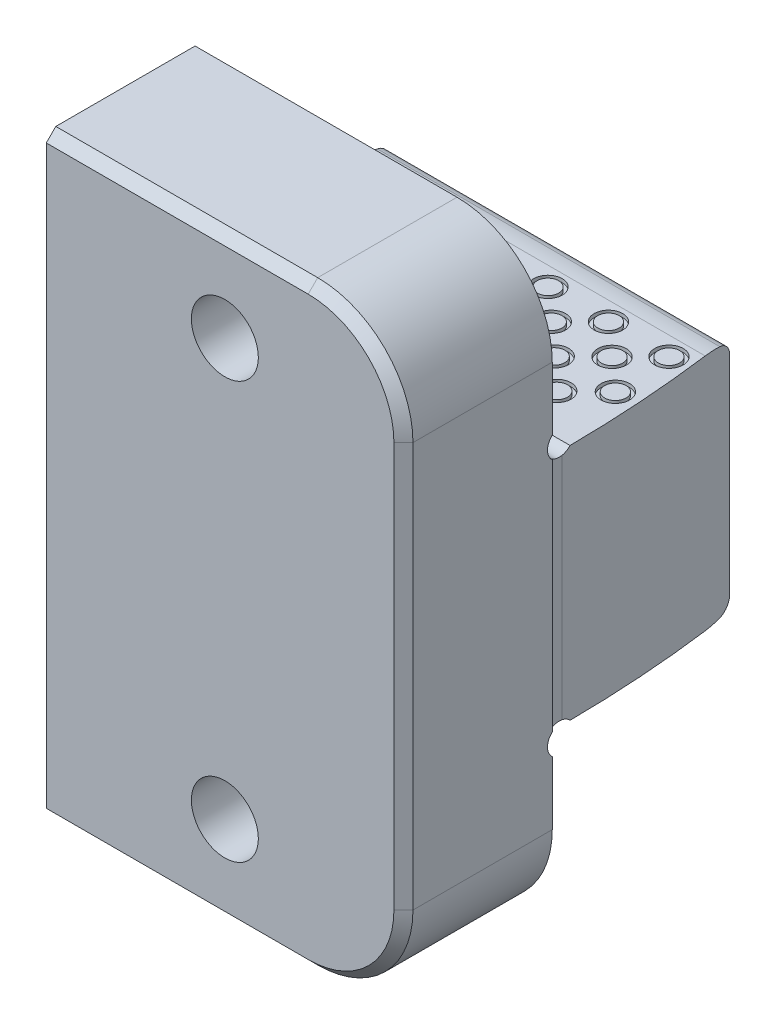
SolidWorks part; units mm, degrees
ref_plane "Front Plane" through (0, 0, 0) normal (0, 0, 1) x (1, 0, 0)
ref_plane "Top Plane" through (0, 0, 0) normal (0, 1, 0) x (1, 0, 0)
ref_plane "Right Plane" through (0, 0, 0) normal (1, 0, 0) x (0, 0, -1)
sketch "Sketch3" plane through (0, 0, 0) normal (1, 0, 0) x (0, 0, -1)
  line L0 (0, 20.955) -> (0, -20.955) construction
  line L1 (-15.875, -31.75) -> (0, -31.75)
  line L2 (-15.875, -31.75) -> (-15.875, 31.75)
  line L3 (-15.875, 31.75) -> (0, 31.75)
  line L4 (20.6756, -12.6975) -> (20.6756, 12.6975)
  line L6 (0, -31.75) -> (0, -12.6975)
  line L7 (0, -12.6975) -> (20.6756, -12.6975)
  line L8 (0, 31.75) -> (0, 12.6975)
  line L9 (0, 12.6975) -> (20.6756, 12.6975)
  line L10 (0, 0) -> (50000, 0) construction
  dimension "D1" = 36.5506
  dimension "D2" = 15.875
  dimension "D3" = 63.5
  dimension "D4" = 25.3949
extrude "Extrude1" add sketch "Sketch3" along normal mid plane 38.1
sketch "Sketch7" plane through (19.05, 0, 0) normal (1, 0, 0) x (0, 0, -1)
  line L1 (0, -14.5526) -> (21.9683, -14.5526)
  line L2 (0, -14.5526) -> (0, 17.1683)
  line L3 (0, 17.1683) -> (21.9683, 17.1683)
  line L4 (21.9683, -14.5526) -> (21.9683, 17.1683)
  line L5 (0, -31.75) -> (0, -12.6975) construction
extrude "Cut-Extrude3" cut sketch "Sketch7" against normal blind 0.254
sketch "Sketch8" plane through (19.05, 0, 0) normal (1, 0, 0) x (0, 0, -1)
  line L0 (0, 0) -> (50000, 0) construction
  line L1 (0, -31.75) -> (0, 31.75) construction
  line L2 (0, 12.6975) -> (20.6756, 12.6975) construction
  circle A0 centre (1.016, 13.7135) radius 1.524
  circle A1 centre (1.016, -13.7135) radius 1.524
  dimension "D1" = 1.524
  dimension "D2" = 0.508
  dimension "D3" = 0.508
extrude "Cut-Extrude4" cut sketch "Sketch8" against normal through all
sketch "Sketch9" plane through (19.05, 0, 0) normal (1, 0, 0) x (0, 0, -1)
  line L0 (2.1519, 12.6975) -> (20.6756, 12.6975) construction
  line L1 (20.6756, 12.6975) -> (20.6756, -12.6975) construction
  line L2 (0, 0) -> (50000, 0) construction
  line L3 (20.6756, 11.027) -> (23.9776, 11.027)
  line L4 (17.6276, 12.6975) -> (17.6276, 17.377)
  line L5 (17.6276, 17.377) -> (23.9776, 17.377)
  line L6 (23.9776, 11.027) -> (23.9776, 17.377)
  line L7 (23.9776, -11.027) -> (23.9776, -17.377)
  line L8 (17.6276, -17.377) -> (23.9776, -17.377)
  line L9 (17.6276, -12.6975) -> (17.6276, -17.377)
  line L10 (20.6756, -11.027) -> (23.9776, -11.027)
  arc A0 (17.6276, 12.6975) -> (19.4419, 12.5231) centre (17.6276, 3.1725) cw
  arc A1 (19.4419, 12.5231) -> (20.6756, 11.027) centre (19.1516, 11.027) cw
  arc A2 (19.4419, -12.5231) -> (20.6756, -11.027) centre (19.1516, -11.027) ccw
  arc A3 (17.6276, -12.6975) -> (19.4419, -12.5231) centre (17.6276, -3.1725) ccw
  dimension "D1" = 1.524
  dimension "D2" = 9.525
  dimension "D3" = 3.048
  dimension "D4" = 6.35
  dimension "D5" = 6.35
extrude "Cut-Extrude5" cut sketch "Sketch9" against normal through all
sketch "Sketch13" plane through (0, 31.75, 0) normal (0, 1, 0) x (1, 0, 0)
  line L0 (18.796, 2.1519) -> (18.796, 17.6276) construction
  line L2 (16.2301, 26.67) -> (28.9301, 26.67)
  line L4 (18.796, 1.27) -> (28.9301, 1.27)
  line L5 (28.9301, 26.67) -> (28.9301, 1.27)
  arc A0 (16.2301, 26.67) -> (18.796, 1.27) centre (-108.204, 1.27) cw
  dimension "D1" = 127
  dimension "D2" = 1.27
  dimension "D3" = 25.4
  dimension "D4" = 12.7
extrude "Cut-Extrude6" cut sketch "Sketch13" against normal through all
sketch "Sketch15" plane through (0, 12.6975, 0) normal (0, 1, 0) x (1, 0, 0)
  line L0 (19.05, -15.875) -> (-19.05, -15.875) construction
  line L1 (-19.05, 17.6276) -> (-19.05, 2.1519) construction
  circle A0 centre (-9.9314, 15.621) radius 1.524
  circle A1 centre (-9.9314, 15.621) radius 1.143
  circle A2 centre (-3.4798, 15.621) radius 1.524
  circle A3 centre (-3.4798, 15.621) radius 1.143
  circle A4 centre (-16.383, 15.621) radius 1.524
  circle A5 centre (-16.383, 15.621) radius 1.143
  circle A6 centre (15.875, 15.621) radius 1.524
  circle A7 centre (15.875, 15.621) radius 1.143
  circle A8 centre (9.4234, 15.621) radius 1.524
  circle A9 centre (9.4234, 15.621) radius 1.143
  circle A10 centre (2.9718, 15.621) radius 1.524
  circle A11 centre (2.9718, 15.621) radius 1.143
  circle A12 centre (-6.5786, 12.573) radius 1.524
  circle A13 centre (-6.5786, 12.573) radius 1.143
  circle A14 centre (-0.1016, 12.573) radius 1.524
  circle A15 centre (-0.1016, 12.573) radius 1.143
  circle A16 centre (-13.0556, 12.573) radius 1.524
  circle A17 centre (-13.0556, 12.573) radius 1.143
  circle A20 centre (12.8524, 12.573) radius 1.524
  circle A21 centre (12.8524, 12.573) radius 1.143
  circle A22 centre (6.3754, 12.573) radius 1.524
  circle A23 centre (6.3754, 12.573) radius 1.143
  circle A24 centre (-9.8552, 9.525) radius 1.524
  circle A25 centre (-9.8552, 9.525) radius 1.143
  circle A26 centre (-3.3274, 9.525) radius 1.524
  circle A27 centre (-3.3274, 9.525) radius 1.143
  circle A28 centre (-16.383, 9.525) radius 1.524
  circle A29 centre (-16.383, 9.525) radius 1.143
  circle A30 centre (16.256, 9.525) radius 1.524
  circle A31 centre (16.256, 9.525) radius 1.143
  circle A32 centre (9.7282, 9.525) radius 1.524
  circle A33 centre (9.7282, 9.525) radius 1.143
  circle A34 centre (3.2004, 9.525) radius 1.524
  circle A35 centre (3.2004, 9.525) radius 1.143
  circle A36 centre (-6.5278, 6.477) radius 1.524
  circle A37 centre (-6.5278, 6.477) radius 1.143
  circle A38 centre (0, 6.477) radius 1.524
  circle A39 centre (0, 6.477) radius 1.143
  circle A40 centre (-13.0556, 6.477) radius 1.524
  circle A41 centre (-13.0556, 6.477) radius 1.143
  circle A44 centre (13.0556, 6.477) radius 1.524
  circle A45 centre (13.0556, 6.477) radius 1.143
  circle A46 centre (6.5278, 6.477) radius 1.524
  circle A47 centre (6.5278, 6.477) radius 1.143
  dimension "D1" = 31.496
  dimension "D2" = 3.048
  dimension "D12" = 6.4516
  dimension "D7" = 3.048
  dimension "D8" = 2.286
  dimension "D3" = 3.048
  dimension "D4" = 3.048
  dimension "D5" = 2.667
  dimension "D6" = 5.9944
  dimension "D9" = 6.4516
  dimension "D10" = 6.4516
  dimension "D11" = 6.4516
  dimension "D13" = 6.4516
  dimension "D14" = 6.477
  dimension "D15" = 6.477
  dimension "D16" = 6.477
  dimension "D17" = 6.477
  dimension "D18" = 6.5278
  dimension "D19" = 6.5278
  dimension "D20" = 6.5278
  dimension "D21" = 6.5278
  dimension "D22" = 6.5278
  dimension "D23" = 6.5278
  dimension "D24" = 6.5278
  dimension "D25" = 6.5278
  dimension "D26" = 6.5278
extrude "Cut-Extrude7" cut sketch "Sketch15" against normal blind 0.381
mirror "Mirror1" about plane through (0, 0, 0) normal (0, 1, 0) of "Cut-Extrude7"
hole_wizard "1/4\"-20 CBORE" positions "Sketch11" profile "Sketch10" counterbore size "1/4" standard "Ansi Inch"
sketch "Sketch11" plane through (0, 0, 0) normal (0, 0, -1) x (-1, 0, 0)
  line L0 (0, 0) -> (0, 50000) construction
  line L1 (0, 0) -> (50000, 0) construction
  point P0 (0, 22.225)
  point P10 (0, -22.225)
  dimension "D1" = 44.45
sketch "Sketch10" plane through (0, 22.225, 0) normal (1, 0, 0) x (0, 1, 0)
  line L0 (0, 0) -> (0, 15.875)
  line L1 (0, 15.875) -> (3.5712, 15.875)
  line L3 (3.5712, 15.875) -> (3.5712, 7.145)
  line L4 (3.5712, 7.145) -> (5.5562, 7.145)
  line L5 (5.5562, 7.145) -> (5.5562, 0)
  line L7 (5.5562, 0) -> (0, 0)
  line L11 (0, -6.35) -> (0, 107.95) construction
  dimension "Thru Hole Dia." = 7.1425
  dimension "Thru Hole Depth" = 15.875
  dimension "C'Bore Dia." = 11.1125
  dimension "C'Bore Depth" = 7.145
fillet "Fillet1" radius 10.16 2 edges at (19.05, -31.75, 7.9375) (19.05, 31.75, 7.9375)
chamfer "Chamfer1" distance 1.016 angle 45 5 edges at (-5.08, 31.75, 15.875) (-5.08, -31.75, 15.875) (19.05, 0, 15.875) (16.0742, 28.7742, 15.875) (16.0742, -28.7742, 15.875)
